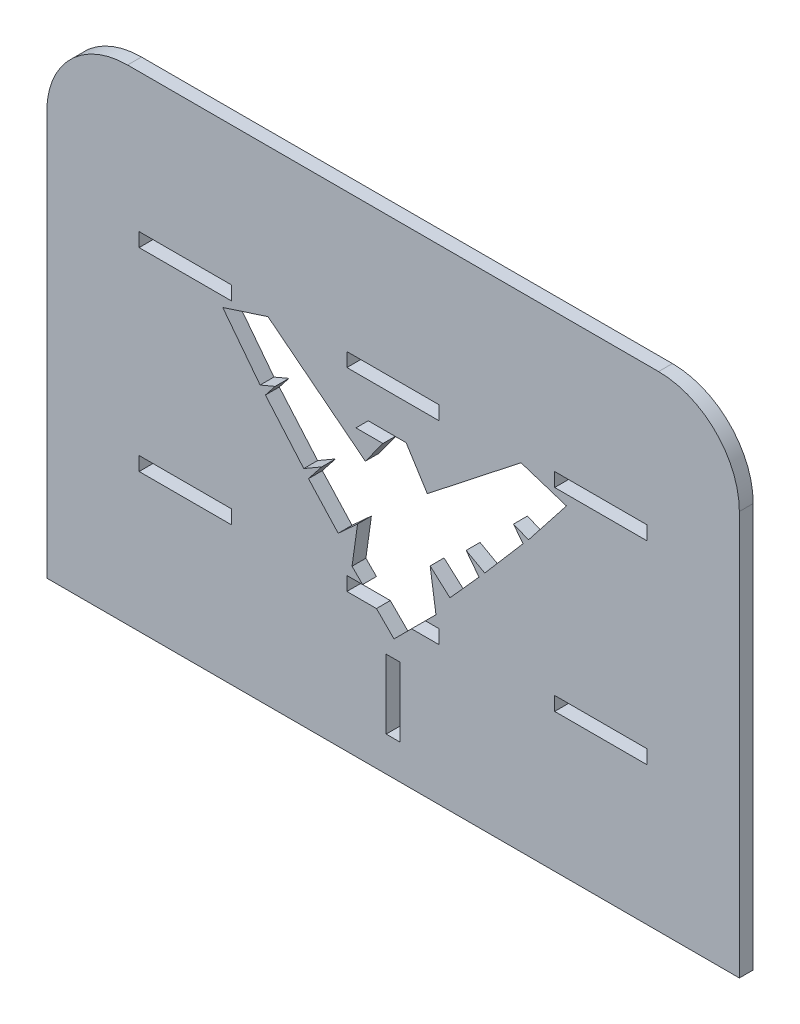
SolidWorks part; units mm, degrees
ref_plane "Alzado" through (0, 0, 0) normal (0, 0, 1) x (1, 0, 0)
ref_plane "Planta" through (0, 0, 0) normal (0, 1, 0) x (1, 0, 0)
ref_plane "Vista lateral" through (0, 0, 0) normal (1, 0, 0) x (0, 0, -1)
sketch "Croquis1" plane through (0, 0, 0) normal (0, 0, 1) x (1, 0, 0)
  line L0 (-410, 210) -> (390, 210) construction
  line L1 (-300, 0) -> (300, 0)
  line L2 (-300, 0) -> (-300, 350)
  line L3 (-230, 420) -> (230, 420)
  line L4 (300, 0) -> (300, 350)
  line L5 (0, -90) -> (0, 410) construction
  line L6 (140, 294) -> (220, 294) construction
  line L7 (-140, 288) -> (-220, 288)
  line L8 (-140, 288) -> (-140, 300)
  line L9 (-140, 300) -> (-220, 300)
  line L10 (-220, 288) -> (-220, 300)
  line L11 (-180, 300) -> (-180, 288) construction
  line L12 (-140, 294) -> (-220, 294) construction
  line L13 (180, 300) -> (180, 288) construction
  line L14 (220, 288) -> (220, 300)
  line L15 (140, 300) -> (220, 300)
  line L16 (140, 288) -> (140, 300)
  line L17 (140, 288) -> (220, 288)
  line L18 (-40, 126) -> (40, 126) construction
  line L19 (-40, 288) -> (40, 288)
  line L20 (-40, 288) -> (-40, 300)
  line L21 (-40, 300) -> (40, 300)
  line L22 (40, 288) -> (40, 300)
  line L23 (0, 300) -> (0, 288) construction
  line L24 (-40, 294) -> (40, 294) construction
  line L25 (0, 120) -> (0, 132) construction
  line L26 (180, 120) -> (180, 132) construction
  line L27 (-140, 126) -> (-220, 126) construction
  line L28 (-180, 120) -> (-180, 132) construction
  line L29 (140, 126) -> (220, 126) construction
  line L30 (40, 132) -> (40, 120)
  line L31 (-40, 120) -> (40, 120)
  line L32 (-40, 132) -> (-40, 120)
  line L33 (-40, 132) -> (40, 132)
  line L34 (140, 132) -> (220, 132)
  line L35 (140, 132) -> (140, 120)
  line L36 (140, 120) -> (220, 120)
  line L37 (220, 132) -> (220, 120)
  line L38 (-220, 132) -> (-220, 120)
  line L39 (-140, 120) -> (-220, 120)
  line L40 (-140, 132) -> (-140, 120)
  line L41 (-140, 132) -> (-220, 132)
  line L43 (6, 30) -> (-6, 30)
  line L44 (6, 30) -> (6, 90)
  line L45 (6, 90) -> (-6, 90)
  line L46 (-6, 30) -> (-6, 90)
  line L47 (0, 90) -> (0, 30) construction
  line L48 (6, 60) -> (-6, 60) construction
  arc A0 (-230, 420) -> (-300, 350) centre (-230, 350) ccw
  arc A1 (300, 350) -> (230, 420) centre (230, 350) ccw
  point P15 (300, 420)
  point P16 (-180, 294)
  point P26 (180, 294)
  point P27 (0, 294)
  point P55 (0, 126)
  point P56 (180, 126)
  point P57 (-180, 126)
  point P58 (0, 60)
extrude "Saliente-Extruir1" add sketch "Croquis1" along normal blind 12
sketch "Croquis2" plane through (0, 0, 0) normal (0, 0, 1) x (1, 0, 0)
  line L0 (-360.6771, 351.4442) -> (39.9895, 351.4442) construction
  line L1 (29.6627, 228.2098) -> (11.3136, 257.2931)
  line L2 (11.3136, 257.2931) -> (-21.5313, 257.2931)
  line L3 (-21.5313, 257.2931) -> (-32.1738, 246.6506)
  line L4 (-32.1738, 246.6506) -> (-8.7786, 246.6506)
  line L5 (-8.7786, 246.6506) -> (-24.0084, 225.7327)
  line L6 (-24.0084, 225.7327) -> (-108.3887, 292.0002)
  line L7 (-108.3887, 292.0002) -> (-147.5685, 279.2828)
  line L8 (-147.5685, 279.2828) -> (-115.197, 237.2769)
  line L9 (-115.197, 237.2769) -> (-102.2227, 242.7515)
  line L10 (-102.2227, 242.7515) -> (-110.5961, 232.0894)
  line L11 (-110.5961, 232.0894) -> (-77.3662, 193.5278)
  line L12 (-77.3662, 193.5278) -> (-61.9135, 202.4758)
  line L13 (-61.9135, 202.4758) -> (-73.2827, 187.9991)
  line L14 (-73.2827, 187.9991) -> (-47.5679, 159.8849)
  line L15 (-47.5679, 159.8849) -> (-30.7727, 175.2468)
  line L16 (-30.7727, 175.2468) -> (-35.553, 141.1474)
  line L17 (-35.553, 141.1474) -> (0.8048, 104.7897)
  line L18 (0.8048, 104.7897) -> (37.1626, 141.1474)
  line L19 (37.1626, 141.1474) -> (32.1281, 175.2468)
  line L20 (32.1281, 175.2468) -> (49.2698, 159.8849)
  line L21 (49.2698, 159.8849) -> (74.4649, 187.9991)
  line L22 (74.4649, 187.9991) -> (63.3085, 202.4758)
  line L23 (63.3085, 202.4758) -> (79.4196, 193.5278)
  line L24 (79.4196, 193.5278) -> (112.5708, 232.0894)
  line L25 (112.5708, 232.0894) -> (104.3541, 242.7515)
  line L26 (104.3541, 242.7515) -> (117.3312, 237.4204)
  line L27 (117.3312, 237.4204) -> (150.2077, 279.2828)
  line L28 (150.2077, 279.2828) -> (110.8427, 292.0002)
  line L29 (110.8427, 292.0002) -> (29.6627, 228.2098)
extrude "Cortar-Extruir1" cut sketch "Croquis2" along normal through all
equation "\"Material\"= 12mm"
equation "\"D5@Croquis1\"=\"Material\""
equation "\"Pestaña\"= 80mm"
equation "\"DsPared\"= 80"
equation "\"D6@Croquis1\"=\"DsPared\""
equation "\"D7@Croquis1\"=\"Pestaña\""
equation "\"D9@Croquis1\"=\"DsPared\""
equation "\"D10@Croquis1\"=\"Material\""
equation "\"D14@Croquis1\"=\"Material\""
equation "\"D15@Croquis1\"=\"PestañaBaja\""
equation "\"PestañaBaja\"= 60"
equation "\"D11@Croquis1\"=\"Pestaña\""
equation "\"LargoMesa\"= 600"
equation "\"D1@Croquis1\"=\"LargoMesa\""
equation "\"Alto\"= 420"
equation "\"D2@Croquis1\"=\"Alto\""
